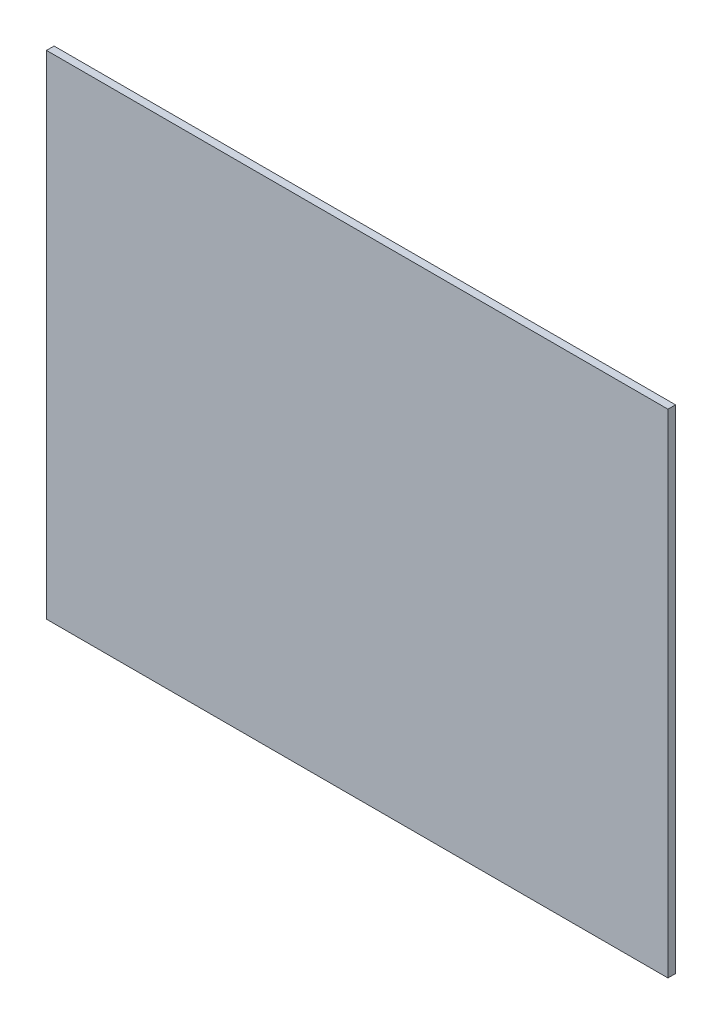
SolidWorks part; units mm, degrees
ref_plane "Front Plane" through (0, 0, 0) normal (0, 0, 1) x (1, 0, 0)
ref_plane "Top Plane" through (0, 0, 0) normal (0, 1, 0) x (1, 0, 0)
ref_plane "Right Plane" through (0, 0, 0) normal (1, 0, 0) x (0, 0, -1)
sketch "Sketch1" plane through (0, 0, 0) normal (0, 0, 1) x (1, 0, 0)
  line L1 (-520.7, -412.75) -> (520.7, -412.75)
  line L2 (-520.7, -412.75) -> (-520.7, 412.75)
  line L3 (-520.7, 412.75) -> (520.7, 412.75)
  line L4 (520.7, -412.75) -> (520.7, 412.75)
  line L5 (-520.7, -412.75) -> (520.7, 412.75) construction
  line L6 (-520.7, 412.75) -> (520.7, -412.75) construction
  point P0 (0, 0)
  dimension "D1" = 1041.4
  dimension "D2" = 825.5
extrude "Extrude1" add sketch "Sketch1" along normal mid plane 12.7
